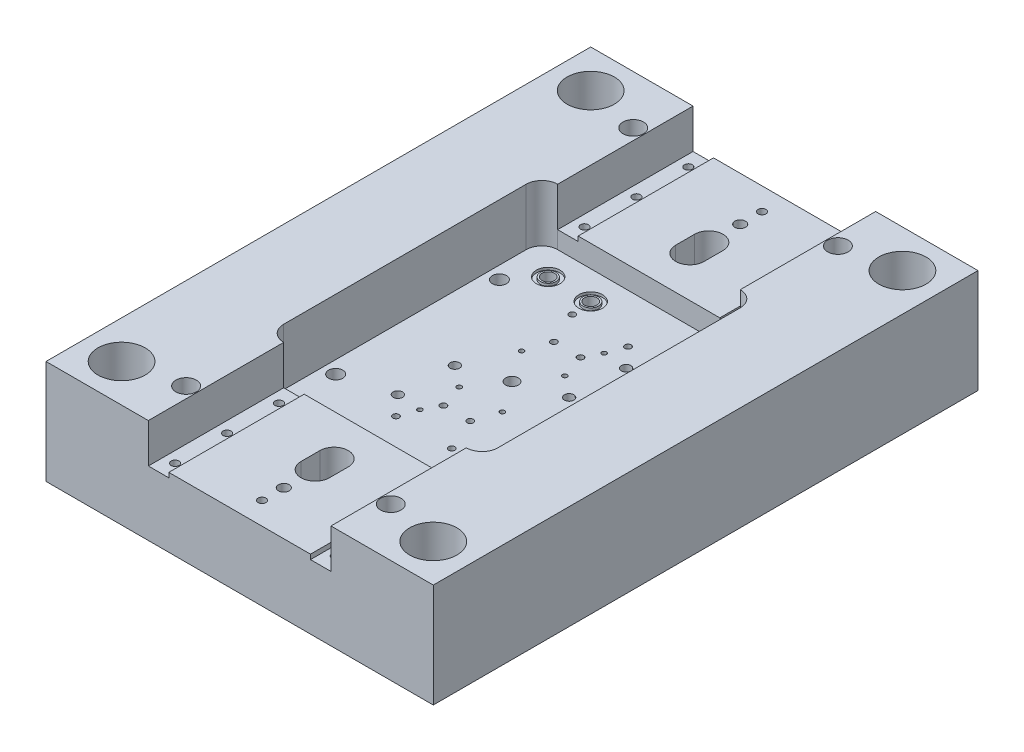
SolidWorks part; units mm, degrees
ref_plane "Plan de face" through (0, 0, 0) normal (0, 0, 1) x (1, 0, 0)
ref_plane "Plan de dessus" through (0, 0, 0) normal (0, 1, 0) x (1, 0, 0)
ref_plane "Plan de droite" through (0, 0, 0) normal (1, 0, 0) x (0, 0, -1)
imported_body "Importée1"
ref_plane "Plan1" through (0, -53, 0) normal (0, -1, 0) x (1, 0, 0)
sketch "Esquisse1" plane through (0, -53, 0) normal (0, -1, 0) x (1, 0, 0)
  line L0 (-52.853, -86) -> (-52.3981, -71.3901)
  line L1 (-51.1275, -70.6565) -> (-46, -70.6565)
  line L2 (-50, -70.0055) -> (-51.1275, -70.6565) construction
  line L4 (-52.853, -86) -> (-46, -86)
  line L6 (-46, -70.0055) -> (-46, -109.725) construction
  line L7 (-42, -70.0055) -> (-50, -70.0055) construction
  line L8 (-51.1275, -70.6565) -> (-40.8725, -70.6565) construction
  line L9 (-57, -86) -> (-35, -86) construction
  line L10 (-46, -86) -> (-46, -70.6565)
  line L11 (-51.1275, -70.6565) -> (-52.3981, -71.3901)
  line L12 (-50, -70.0055) -> (-51.1275, -70.6565) construction
  point P3 (-52.489, -74.3091)
  point P13 (-51.1275, -70.6565)
revolve "Enlèvement de matière-Révolution1" cut sketch "Esquisse1" angle 360 about L6
pattern_linear "Répétition linéaire1" count 2 spacing 27 along (1, 0, 0) of "Enlèvement de matière-Révolution1"
